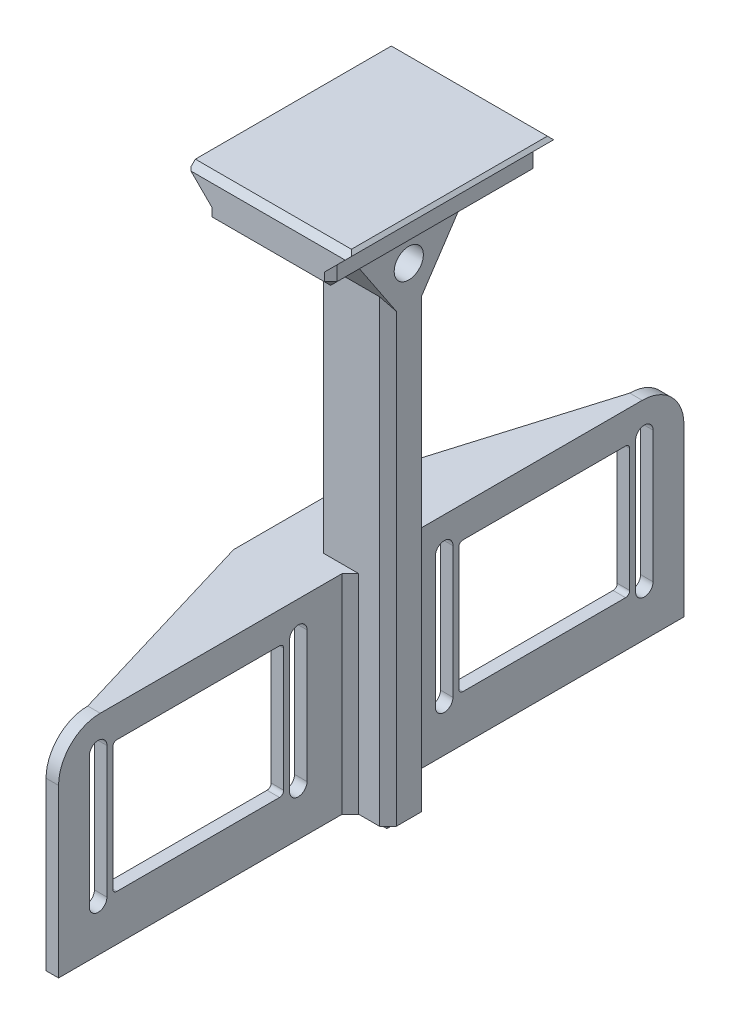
SolidWorks part; units mm, degrees
ref_plane "前视基准面" through (0, 0, 0) normal (0, 0, 1) x (1, 0, 0)
ref_plane "上视基准面" through (0, 0, 0) normal (0, 1, 0) x (1, 0, 0)
ref_plane "右视基准面" through (0, 0, 0) normal (1, 0, 0) x (0, 0, -1)
sketch "草图2" plane through (0, 0, 0) normal (0, 1, 0) x (1, 0, 0)
  line L1 (0, 0) -> (17.5, 0)
  line L2 (0, 0) -> (0, 10)
  line L3 (0, 10) -> (17.5, 10)
  line L4 (17.5, 0) -> (17.5, 10)
  dimension "D1" = 17.5
  dimension "D2" = 10
extrude "凸台-拉伸1" add sketch "草图2" along normal blind 125
sketch "草图3" plane through (0, 125, 0) normal (0, 1, 0) x (1, 0, 0)
  line L0 (0, 10) -> (0, 0) construction
  line L1 (-16.25, 20) -> (33.75, 20)
  line L2 (-16.25, 20) -> (-16.25, -10)
  line L3 (-16.25, -10) -> (33.75, -10)
  line L4 (33.75, 20) -> (33.75, -10)
  line L5 (0, 0) -> (17.5, 0) construction
  line L10 (0, 10) -> (0, 0)
  line L11 (0, 0) -> (17.5, 0)
  line L12 (17.5, 0) -> (17.5, 10)
  line L13 (17.5, 10) -> (0, 10)
  line L15 (0, 0) -> (0.4167, 0)
  point P0 (8.75, 5)
  dimension "D1" = 50
  dimension "D2" = 30
  dimension "D3" = 0
  dimension "D4" = 0.4167
  dimension "D5" = 8.75
  dimension "D6" = 33.75
  dimension "D7" = 5
  dimension "D8" = 20
extrude "凸台-拉伸2" add sketch "草图3" along normal blind 7.5 contours L3 L4 L1 L2
chamfer "倒角1" distance 1 angle 45 4 edges at (8.75, 132.5, -20) (-16.25, 132.5, -5) (8.75, 132.5, 10) (33.75, 132.5, -5)
sketch "草图5" plane through (17.5, 0, 0) normal (1, 0, 0) x (0, 0, -1)
  line L0 (10, 125) -> (20, 125)
  line L1 (20, 125) -> (10, 110)
  line L2 (10, 125) -> (10, 0) construction
  line L3 (10, 110) -> (10, 125)
  line L4 (0, 125) -> (-10, 125)
  line L5 (-10, 125) -> (0, 110)
  line L6 (0, 125) -> (0, 0) construction
  line L7 (0, 110) -> (0, 125)
  dimension "D1" = 15
  dimension "D2" = 15
extrude "凸台-拉伸3" add sketch "草图5" against normal blind 17.5
chamfer "倒角2" distance 2 angle 45 6 edges at (25.625, 125, -20) (33.75, 125, -5) (25.625, 125, 10) (-8.125, 125, -20) (-8.125, 125, 10) (-16.25, 125, -5)
chamfer "倒角3" distance 2 angle 45 4 edges at (17.5, 55, 0) (17.5, 55, -10) (0, 55, -10) (0, 55, 0)
sketch "草图6" plane through (0, 0, 0) normal (0, -1, 0) x (1, 0, 0)
  line L1 (3.75, -3.5) -> (13.75, -3.5)
  line L2 (3.75, -3.5) -> (3.75, -6.5)
  line L3 (3.75, -6.5) -> (13.75, -6.5)
  line L4 (13.75, -3.5) -> (13.75, -6.5)
  line L5 (3.75, -3.5) -> (13.75, -6.5) construction
  line L6 (3.75, -6.5) -> (13.75, -3.5) construction
  point P0 (8.75, -5)
  dimension "D1" = 10
  dimension "D2" = 3
extrude "凸台-拉伸4" add sketch "草图6" along normal blind 3.1
ref_plane "基准面4" through (8.75, 0, 0) normal (-1, 0, 0) x (0, 0, 1)
ref_plane "基准面5" through (0, 0, -5) normal (0, 0, -1) x (-1, 0, 0)
sketch "草图7" plane through (8.75, 0, 0) normal (-1, 0, 0) x (0, 0, 1)
  line L0 (-10, 0) -> (-80, 0)
  line L2 (-10, 0) -> (-10, 110) construction
  line L3 (-10, 50) -> (-10, 0)
  line L4 (-10, 50) -> (-80, 50)
  line L5 (-80, 50) -> (-80, 0)
  dimension "D1" = 70
  dimension "D2" = 50
extrude "凸台-拉伸5" add sketch "草图7" along normal blind 3.25 contours L0 L5 L4 L3
mirror "镜向1" about plane through (0, 0, -5) normal (0, 0, -1) of "凸台-拉伸5"
ref_plane "基准面7" through (0, 0, -5) normal (0, 0, 1) x (1, 0, 0)
sketch "草图15" plane through (8.75, 0, 0) normal (1, 0, 0) x (0, 0, -1)
  line L1 (-70, 50) -> (0, 50)
  line L2 (-70, 50) -> (-70, 0)
  line L3 (-70, 0) -> (0, 0)
  line L4 (0, 50) -> (0, 0)
  line L5 (10, 50) -> (80, 50)
  line L6 (10, 50) -> (10, 0)
  line L7 (10, 0) -> (80, 0)
  line L8 (80, 50) -> (80, 0)
extrude "切除-拉伸7" cut sketch "草图15" against normal blind 0.25
sketch "草图16" plane through (5.5, 0, 0) normal (-1, 0, 0) x (0, 0, 1)
  line L0 (-10, 0) -> (-10, 110) construction
  line L1 (-26, 42.5) -> (-67, 42.5)
  line L2 (-26, 42.5) -> (-26, 11)
  line L3 (-26, 11) -> (-67, 11)
  line L4 (-67, 42.5) -> (-67, 11)
  line L5 (-10, 0) -> (-80, 0) construction
  line L6 (-10, 50) -> (-80, 50) construction
  line L7 (-5, 0) -> (-5, 28.0891) construction
  line L9 (16, 11) -> (57, 11)
  line L10 (57, 42.5) -> (57, 11)
  line L11 (16, 42.5) -> (57, 42.5)
  line L12 (16, 42.5) -> (16, 11)
  dimension "D1" = 41
  dimension "D2" = 16
  dimension "D3" = 11
  dimension "D4" = 7.5
extrude "切除-拉伸8" cut sketch "草图16" against normal blind 39.25
chamfer "倒角7" distance 2 angle 45 4 edges at (8.5, 25, 0) (8.5, 25, -10) (5.5, 25, -10) (5.5, 25, 0)
fillet "圆角1" radius 1 8 edges at (7, 11, -67) (7, 11, -26) (7, 42.5, -26) (7, 42.5, -67) (7, 11, 57) (7, 42.5, 57) (7, 42.5, 16) (7, 11, 16)
fillet "圆角2" radius 10 2 edges at (7, 50, -80) (7, 50, 70)
sketch "草图17" plane through (0, 50, 0) normal (0, 1, 0) x (1, 0, 0)
  line L0 (5.5, 70) -> (-9.5, 20)
  line L1 (-16.25, 20) -> (33.75, 20) construction
  line L2 (-9.5, 20) -> (-9.5, -10)
  line L3 (33.75, -10) -> (-16.25, -10) construction
  line L4 (-9.5, -10) -> (5.5, -60)
  line L5 (5.5, 12) -> (5.5, 70) construction
  line L6 (5.5, 70) -> (5.5, -60)
  dimension "D1" = 15
extrude "凸台-拉伸7" add sketch "草图17" against normal blind 3
sketch "草图19" plane through (0, 132.5, 0) normal (0, 1, 0) x (1, 0, 0)
  line L1 (-40.8384, 31.8182) -> (60.9408, 31.8182)
  line L2 (-40.8384, 31.8182) -> (-40.8384, -16.4691)
  line L3 (-40.8384, -16.4691) -> (60.9408, -16.4691)
  line L4 (60.9408, 31.8182) -> (60.9408, -16.4691)
extrude "切除-拉伸10" cut sketch "草图19" against normal blind 7.5
ref_plane "基准面8" through (0, 125, 10) normal (0, 0, 1) x (1, 0, 0)
sketch "草图21" plane through (0, 125, 0) normal (0, 1, 0) x (1, 0, 0)
  line L1 (-6.25, 30) -> (23.75, 30)
  line L2 (-6.25, 30) -> (-6.25, -20)
  line L3 (-6.25, -20) -> (23.75, -20)
  line L4 (23.75, 30) -> (23.75, -20)
  point P0 (8.75, 5)
  dimension "D1" = 50
  dimension "D2" = 30
extrude "凸台-拉伸8" add sketch "草图21" along normal blind 10 contours L4 L1 L3 M12 | M12 M9 M10 M11 | L2 L3 L1 M10
sketch "草图23" plane through (0, 0, 20) normal (0, 0, 1) x (1, 0, 0)
  line L0 (23.75, 130) -> (23.75, 135)
  line L1 (23.75, 135) -> (23.75, 125) construction
  line L2 (23.75, 130) -> (28.75, 135)
  line L3 (28.75, 135) -> (23.75, 135)
  line L7 (-11.25, 135) -> (-6.25, 135)
  line L8 (-6.25, 130) -> (-11.25, 135)
  line L9 (-6.25, 130) -> (-6.25, 135)
extrude "凸台-拉伸9" add sketch "草图23" against normal blind 50
sketch "草图24" plane through (0, 0, 0) normal (-1, 0, 0) x (0, 0, 1)
  line L0 (-8, 47) -> (-8, 0) construction
  line L1 (-2, 0) -> (-8, 0)
  line L2 (-2, 0) -> (-2, 6)
  line L3 (-2, 6) -> (-8, 6)
  line L4 (-8, 0) -> (-8, 6)
  line L5 (94.9, 6) -> (-105.1, 6) construction
extrude "凸台-拉伸10" add sketch "草图24" along normal blind 2
sketch "草图25" plane through (8.5, 0, 0) normal (1, 0, 0) x (0, 0, -1)
  line L0 (-12.5, 11) -> (-12.5, 42.5) construction
  line L1 (-14.6, 11) -> (-14.6, 42.5)
  line L2 (-10.4, 11) -> (-10.4, 42.5)
  line L3 (-56, 11) -> (-17, 11) construction
  line L4 (-17, 42.5) -> (-56, 42.5) construction
  line L5 (-16, 12) -> (-16, 41.5) construction
  line L6 (-36.5, 42.5) -> (-36.5, 11) construction
  line L7 (5, 0) -> (5, 11) construction
  line L8 (2, 0) -> (8, 0) construction
  line L9 (-60.5, 11) -> (-60.5, 42.5) construction
  line L10 (-58.4, 11) -> (-58.4, 42.5)
  line L11 (-62.6, 11) -> (-62.6, 42.5)
  line L12 (22.5, 11) -> (22.5, 42.5) construction
  line L13 (24.6, 11) -> (24.6, 42.5)
  line L14 (20.4, 11) -> (20.4, 42.5)
  line L15 (70.5, 11) -> (70.5, 42.5) construction
  line L16 (68.4, 11) -> (68.4, 42.5)
  line L17 (72.6, 11) -> (72.6, 42.5)
  arc A0 (-14.6, 11) -> (-10.4, 11) centre (-12.5, 11) ccw
  arc A1 (-10.4, 42.5) -> (-14.6, 42.5) centre (-12.5, 42.5) ccw
  arc A2 (-58.4, 11) -> (-62.6, 11) centre (-60.5, 11) cw
  arc A3 (-62.6, 42.5) -> (-58.4, 42.5) centre (-60.5, 42.5) cw
  arc A4 (24.6, 11) -> (20.4, 11) centre (22.5, 11) cw
  arc A5 (20.4, 42.5) -> (24.6, 42.5) centre (22.5, 42.5) cw
  arc A6 (68.4, 11) -> (72.6, 11) centre (70.5, 11) ccw
  arc A7 (72.6, 42.5) -> (68.4, 42.5) centre (70.5, 42.5) ccw
  point P3 (-12.5, 26.75)
  point P21 (-60.5, 26.75)
  point P28 (22.5, 26.75)
  point P35 (70.5, 26.75)
  dimension "D1" = 2.1
  dimension "D2" = 0
  dimension "D3" = 0
  dimension "D4" = 3.5
extrude "切除-拉伸11" cut sketch "草图25" against normal blind 44
chamfer "倒角8" distance 1.5 angle 45 12 edges at (-6.25, 125, -5) (-6.25, 127.5, 20) (8.75, 125, 20) (23.75, 127.5, 20) (23.75, 125, -5) (23.75, 127.5, -30) (8.75, 125, -30) (-6.25, 127.5, -30) (-11.25, 135, -5) (8.75, 135, -30) (28.75, 135, -5) (8.75, 135, 20)
chamfer "倒角9" distance 3 angle 45 2 edges at (17.5, 125, -5) (0, 125, -5)
sketch "草图27" plane through (0, 0, 0) normal (-1, 0, 0) x (0, 0, 1)
  line L0 (8, 122) -> (-18, 122) construction
  circle A0 centre (-5, 115.5) radius 3.5
  dimension "D1" = 6.5
extrude "切除-拉伸13" cut sketch "草图27" against normal blind 31
